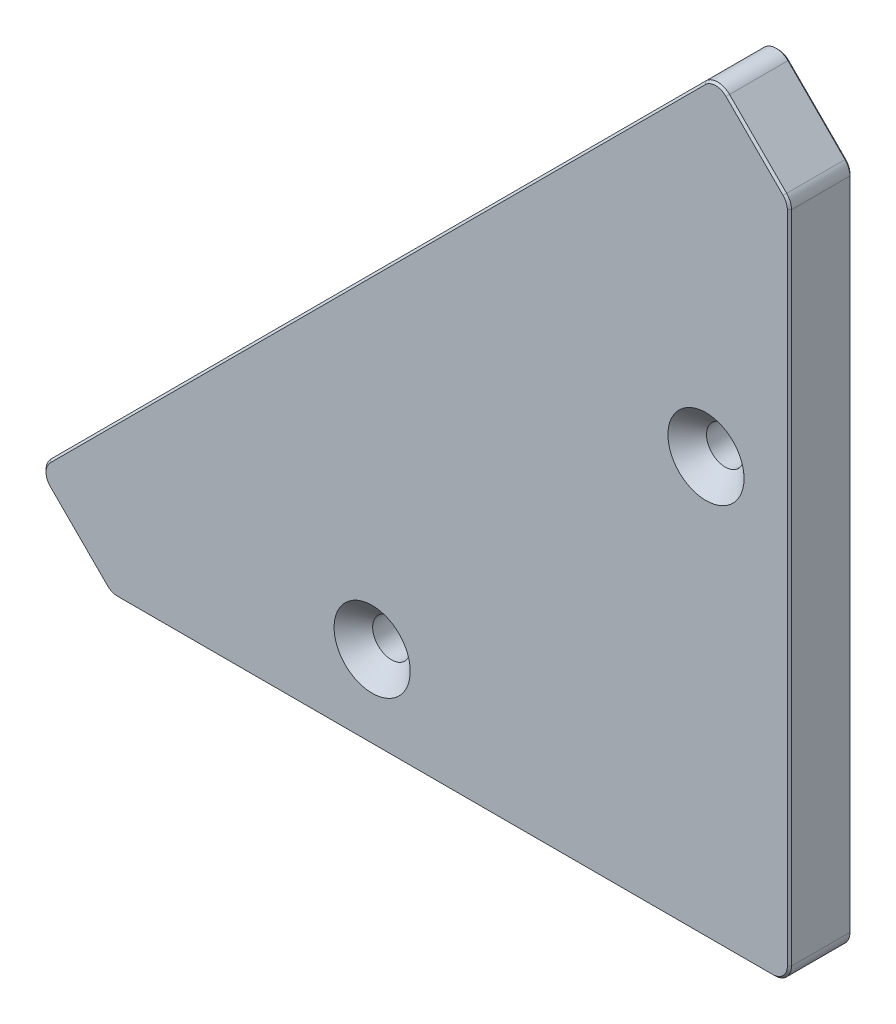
SolidWorks part; units mm, degrees
ref_plane "Ebene vorne" through (0, 0, 0) normal (0, 0, 1) x (1, 0, 0)
ref_plane "Ebene oben" through (0, 0, 0) normal (0, 1, 0) x (1, 0, 0)
ref_plane "Ebene rechts" through (0, 0, 0) normal (1, 0, 0) x (0, 0, -1)
sketch "Skizze1" plane through (0, 0, 0) normal (0, 0, 1) x (1, 0, 0)
  line L0 (0, 0) -> (-197.9899, 0)
  line L1 (-197.9899, 0) -> (0, 197.9899)
  line L2 (0, 197.9899) -> (0, 0)
  dimension "D1" = 280
extrude "Aufsatz-Linear austragen1" add sketch "Skizze1" along normal blind 15
sketch "Skizze4" plane through (0, 0, 0) normal (0, 0, -1) x (-1, 0, 0)
  line L0 (0, 162.6346) -> (17.6777, 180.3122)
  line L1 (0, 0) -> (0, 197.9899) construction
  line L2 (0, 197.9899) -> (197.9899, 0) construction
  line L3 (17.6777, 180.3122) -> (0, 197.9899)
  line L4 (0, 197.9899) -> (0, 162.6346)
  line L5 (162.6346, 0) -> (180.3122, 17.6777)
  line L6 (197.9899, 0) -> (0, 0) construction
  line L7 (180.3122, 17.6777) -> (197.9899, 0)
  line L8 (197.9899, 0) -> (162.6346, 0)
  dimension "D1" = 25
extrude "Schnitt-Linear austragen2" cut sketch "Skizze4" against normal through all
fillet "Verrundung1" radius 4 5 edges at (0, 0, 7.5) (0, 162.6346, 7.5) (-17.6777, 180.3122, 7.5) (-180.3122, 17.6777, 7.5) (-162.6346, 0, 7.5)
hole_wizard "Formsenkung für M8 Senkschraube mit Innensechskant1" positions "Skizze5" profile "Skizze6" countersink size "M8" standard "DIN"
sketch "Skizze5" plane through (0, 0, 15) normal (0, 0, 1) x (1, 0, 0)
  line L0 (0, 4) -> (0, 160.9777) construction
  line L1 (-160.9777, 0) -> (-4, 0) construction
  point P0 (-100, 20)
  point P2 (-20, 100)
sketch "Skizze6" plane through (-100, 20, 15) normal (1, 0, 0) x (0, -1, 0)
  line L0 (0, 0) -> (0, 15)
  line L1 (0, 15) -> (4.5, 15)
  line L2 (4.5, 15) -> (4.5, 4.625)
  line L3 (4.5, 4.625) -> (9.125, 0)
  line L5 (9.125, 0) -> (0, 0)
  line L6 (-4.5, 4.625) -> (-9.125, 0) construction
  line L11 (0, -6.35) -> (0, 107.95) construction
  dimension "Bohrerdurchmesser" = 9
  dimension "Bohrungstiefe" = 15
  dimension "Senkdurchmesser (Oben)" = 18.25
  dimension "Senkwinkel (Oben)" = 90
chamfer "Fase1" distance 0.5 angle 45 20 edges at (-178.6554, 17.6777, 15) (-170.645, 8.0104, 15) (-98.9949, 98.9949, 15) (-162.5084, 0.3045, 15) (-17.6777, 178.6554, 15) (-82.4889, 0, 15) (-8.0104, 170.645, 15) (-1.1716, 1.1716, 15) (-0.3045, 162.5084, 15) (0, 82.4889, 15) (-178.6554, 17.6777, 0) (-170.645, 8.0104, 0) (-98.9949, 98.9949, 0) (-162.5084, 0.3045, 0) (-17.6777, 178.6554, 0) (-82.4889, 0, 0) (-8.0104, 170.645, 0) (-1.1716, 1.1716, 0) (-0.3045, 162.5084, 0) (0, 82.4889, 0)
equation "\"D4@Skizze5\"=\"D3@Skizze5\""
equation "\"D2@Skizze5\"=\"D1@Skizze5\""
